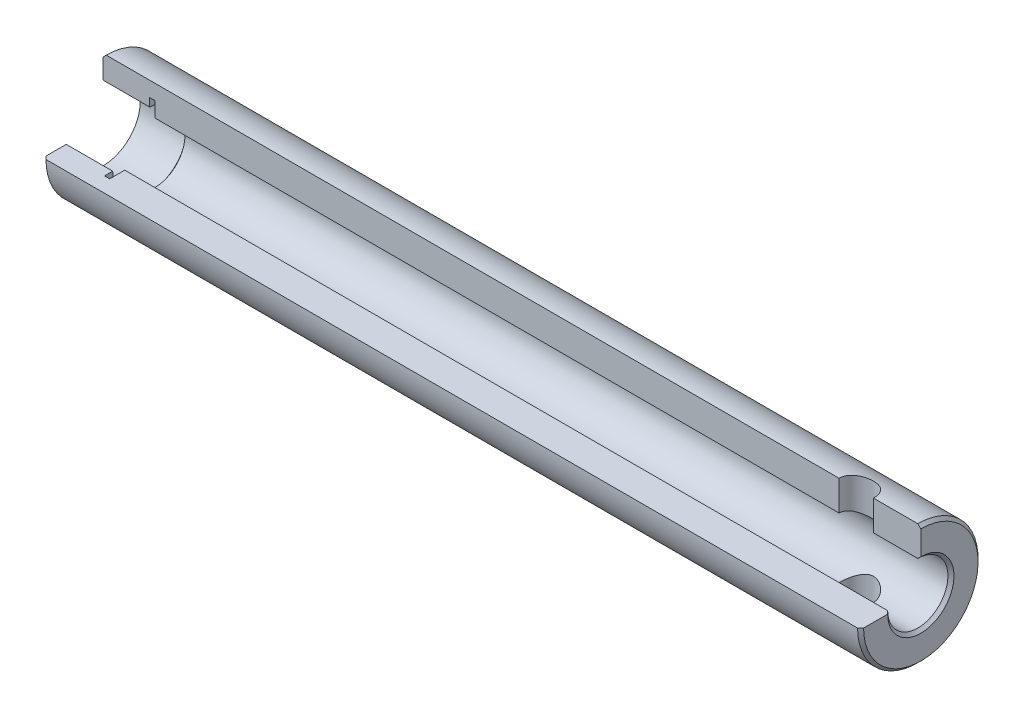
SolidWorks part; units mm, degrees
ref_plane "Face" through (0, 0, 0) normal (0, 0, 1) x (1, 0, 0)
ref_plane "Dessus" through (0, 0, 0) normal (0, 1, 0) x (1, 0, 0)
ref_plane "Droite" through (0, 0, 0) normal (1, 0, 0) x (0, 0, -1)
sketch "Esquisse1" plane through (0, 0, 0) normal (1, 0, 0) x (0, 0, -1)
  circle A0 centre (0, 0) radius 7
  circle A1 centre (0, 0) radius 3.5
  dimension "D1" = 14
  dimension "D2" = 7
extrude "Base-Extrusion" add sketch "Esquisse1" along normal blind 95
chamfer "Chanfrein1" distance 0.35 angle 45 3 edges at (0, 0, -7) (95, 0, -7) (95, 0, -3.5)
sketch "Esquisse2" plane through (0, 0, 0) normal (0, 1, 0) x (1, 0, 0)
  line L0 (-2.2632, 0) -> (102.1544, 0) construction
  line L1 (94.65, 0) -> (0.35, 0) construction
  line L2 (95, -6.65) -> (95, 6.65) construction
  circle A0 centre (87.5, 0) radius 2
  dimension "D1" = 4
  dimension "D2" = 7.5
extrude "Enlèv. mat.-Extru.2" cut sketch "Esquisse2" against normal up to next and the other way up to next
sketch "Esquisse3" plane through (0, 0, 0) normal (-1, 0, 0) x (0, 0, 1)
  circle A0 centre (0, 0) radius 4.3
  dimension "D1" = 8.6
extrude "Enlèv. mat.-Extru.4" cut sketch "Esquisse3" against normal blind 6
sketch "Esquisse6" plane through (6, 0, 0) normal (-1, 0, 0) x (0, 0, 1)
  circle A0 centre (0, 0) radius 3.5 construction
  circle A1 centre (0, 0) radius 3.5
  circle A2 centre (0, 0) radius 5.25
  dimension "D1" = 10.5
extrude "Enlèv. mat.-Extru.5" cut sketch "Esquisse6" along normal blind 0.6
sketch "Esquisse5" plane through (0, 0, 0) normal (1, 0, 0) x (0, 0, -1)
  line L0 (0, 0) -> (-7, 0)
  line L1 (0, 0) -> (0, 7)
  circle A0 centre (0, 0) radius 7 construction
  arc A1 (0, 7) -> (-7, 0) centre (0, 0) ccw
extrude "COUPE" cut sketch "Esquisse5" along normal up to next
